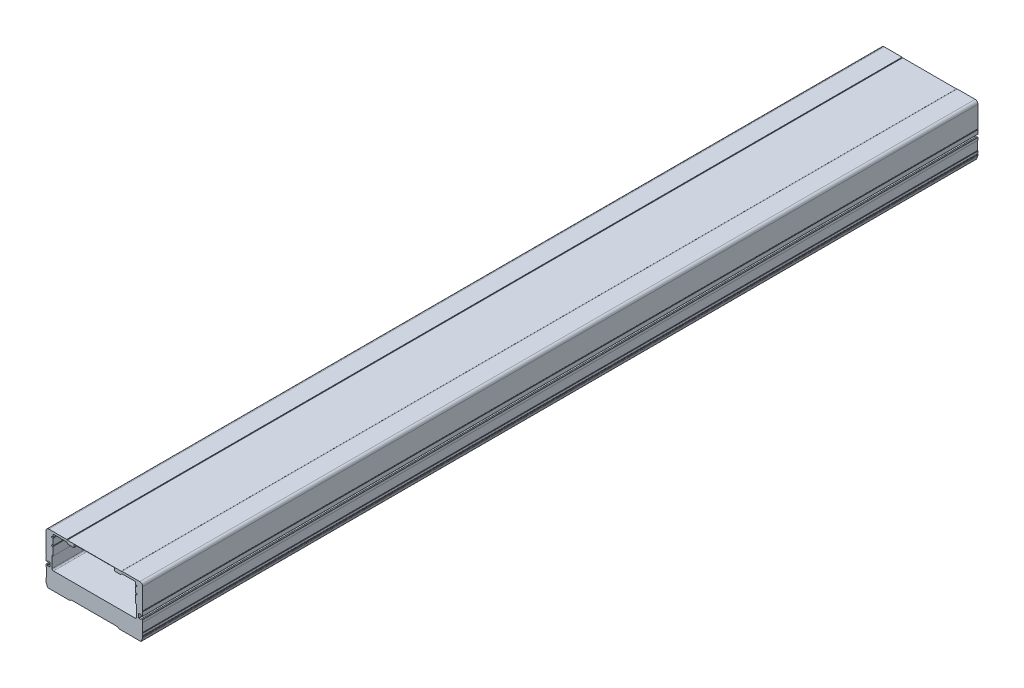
SolidWorks part; units mm, degrees
ref_plane "前视基准面" through (0, 0, 0) normal (0, 0, 1) x (1, 0, 0)
ref_plane "上视基准面" through (0, 0, 0) normal (0, 1, 0) x (1, 0, 0)
ref_plane "右视基准面" through (0, 0, 0) normal (1, 0, 0) x (0, 0, -1)
sketch "草图1" plane through (0, 0, 0) normal (0, 0, 1) x (1, 0, 0)
  line B0 (-57, 22.7) -> (57, 22.7)
  line B1 (-59, 40.3) -> (-59, 24.7)
  line B2 (-57.5, 40.6) -> (-59.3, 40.6)
  line B3 (-57.5, 52.1417) -> (-57.5, 40.6)
  line B4 (-57.5, 62.1417) -> (-57.5, 53.0583)
  line B5 (-57.5, 66.1) -> (-57.5, 63.0583)
  line B6 (-38.5, 67.1) -> (-56.5, 67.1)
  line B7 (-36.5, 65.1) -> (-38.5, 67.1)
  line B8 (-28.8, 65.1) -> (-36.5, 65.1)
  line B9 (-28.5, 69.3) -> (-28.5, 65.4)
  line B10 (28.5, 69.3) -> (-28.5, 69.3)
  line B11 (28.5, 65.4) -> (28.5, 69.3)
  line B12 (36.5, 65.1) -> (28.8, 65.1)
  line B13 (38.5, 67.1) -> (36.5, 65.1)
  line B14 (56.5, 67.1) -> (38.5, 67.1)
  line B15 (57.5, 63.0583) -> (57.5, 66.1)
  line B16 (57.5, 53.0583) -> (57.5, 62.1417)
  line B17 (57.5, 40.6) -> (57.5, 52.1417)
  line B18 (59, 40.6) -> (57.5, 40.6)
  line B19 (59, 24.7) -> (59, 40.6)
  line B20 (-67.5, 66.1) -> (-67.5, 36.6047)
  line B21 (-67.5, 35.3953) -> (-67.5, 30.1)
  line B22 (-67.2, 29.8) -> (-65.8, 29.8)
  line B23 (-65.5, 30.1) -> (-65.5, 30.7)
  line B24 (-65.2, 31) -> (-62.3, 31)
  line B25 (-62, 30.7) -> (-62, 25.3)
  line B26 (-62.3, 25) -> (-65.2, 25)
  line B27 (-65.5, 25.3) -> (-65.5, 25.9)
  line B28 (-65.8, 26.2) -> (-67.2, 26.2)
  line B29 (-67.5, 25.9) -> (-67.5, 22.5)
  line B30 (-67.5, 22.5) -> (-67, 22)
  line B31 (-67, 22) -> (-67, 10)
  line B32 (-67, 10) -> (-67.5, 9.5)
  line B33 (-67.5, 9.5) -> (-67.5, 6.6047)
  line B34 (-67.5, 5.3953) -> (-67.5, 4.382)
  line B35 (-67.3592, 3.6449) -> (-65.5064, -1.0289)
  line B36 (-65.16, -1.6) -> (-34.1, -1.6)
  line B37 (-34.1, -1.6) -> (-32.5, 0)
  line B38 (-32.5, 0) -> (32.5, 0)
  line B39 (32.5, 0) -> (34.1, -1.6)
  line B40 (34.1, -1.6) -> (65.16, -1.6)
  line B41 (65.5064, -1.0289) -> (67.3592, 3.6449)
  line B42 (67.5, 4.382) -> (67.5, 5.3953)
  line B43 (67.5, 6.6047) -> (67.5, 9.5)
  line B44 (67.5, 9.5) -> (67, 10)
  line B45 (67, 10) -> (67, 22)
  line B46 (67, 22) -> (67.5, 22.5)
  line B47 (67.5, 22.5) -> (67.5, 25.9)
  line B48 (67.2, 26.2) -> (65.8, 26.2)
  line B49 (65.5, 25.9) -> (65.5, 25.3)
  line B50 (65.2, 25) -> (62.3, 25)
  line B51 (62, 25.3) -> (62, 30.7)
  line B52 (62.3, 31) -> (65.2, 31)
  line B53 (65.5, 30.7) -> (65.5, 30.1)
  line B54 (65.8, 29.8) -> (67.2, 29.8)
  line B55 (67.5, 30.1) -> (67.5, 35.3953)
  line B56 (67.5, 36.6047) -> (67.5, 66.1)
  line B57 (63.5, 70.1) -> (38.5, 70.1)
  line B58 (38.5, 70.1) -> (38, 69.6)
  line B59 (38, 69.6) -> (37.5, 69.6)
  line B60 (37.5, 69.6) -> (37.5, 69.7)
  line B61 (37.5, 69.7) -> (-37.5, 69.7)
  line B62 (-37.5, 69.7) -> (-37.5, 69.6)
  line B63 (-37.5, 69.6) -> (-38, 69.6)
  line B64 (-38, 69.6) -> (-38.5, 70.1)
  line B65 (-38.5, 70.1) -> (-63.5, 70.1)
  arc B66 (-59, 24.7) -> (-57, 22.7) centre (-57, 24.7) ccw
  arc B67 (-59, 40.3) -> (-59.3, 40.6) centre (-59.3, 40.3) ccw
  arc B68 (-57.5, 53.0583) -> (-57.5, 52.1417) centre (-58.5, 52.6) ccw
  arc B69 (-57.5, 63.0583) -> (-57.5, 62.1417) centre (-58.5, 62.6) ccw
  arc B70 (-56.5, 67.1) -> (-57.5, 66.1) centre (-56.5, 66.1) ccw
  arc B71 (-28.8, 65.1) -> (-28.5, 65.4) centre (-28.8, 65.4) ccw
  arc B72 (28.5, 65.4) -> (28.8, 65.1) centre (28.8, 65.4) ccw
  arc B73 (57.5, 66.1) -> (56.5, 67.1) centre (56.5, 66.1) ccw
  arc B74 (57.5, 62.1417) -> (57.5, 63.0583) centre (58.5, 62.6) ccw
  arc B75 (57.5, 52.1417) -> (57.5, 53.0583) centre (58.5, 52.6) ccw
  arc B76 (57, 22.7) -> (59, 24.7) centre (57, 24.7) ccw
  arc B77 (-67.5, 36.6047) -> (-67.3333, 36.3359) centre (-67.2, 36.6047) ccw
  arc B78 (-67.3333, 35.6641) -> (-67.3333, 36.3359) centre (-67.5, 36) ccw
  arc B79 (-67.3333, 35.6641) -> (-67.5, 35.3953) centre (-67.2, 35.3953) ccw
  arc B80 (-67.5, 30.1) -> (-67.2, 29.8) centre (-67.2, 30.1) ccw
  arc B81 (-65.8, 29.8) -> (-65.5, 30.1) centre (-65.8, 30.1) ccw
  arc B82 (-65.2, 31) -> (-65.5, 30.7) centre (-65.2, 30.7) ccw
  arc B83 (-62, 30.7) -> (-62.3, 31) centre (-62.3, 30.7) ccw
  arc B84 (-62.3, 25) -> (-62, 25.3) centre (-62.3, 25.3) ccw
  arc B85 (-65.5, 25.3) -> (-65.2, 25) centre (-65.2, 25.3) ccw
  arc B86 (-65.5, 25.9) -> (-65.8, 26.2) centre (-65.8, 25.9) ccw
  arc B87 (-67.2, 26.2) -> (-67.5, 25.9) centre (-67.2, 25.9) ccw
  arc B88 (-67.5, 6.6047) -> (-67.3333, 6.3359) centre (-67.2, 6.6047) ccw
  arc B89 (-67.3333, 5.6641) -> (-67.3333, 6.3359) centre (-67.5, 6) ccw
  arc B90 (-67.3333, 5.6641) -> (-67.5, 5.3953) centre (-67.2, 5.3953) ccw
  arc B91 (-67.5, 4.382) -> (-67.3592, 3.6449) centre (-65.5, 4.382) ccw
  arc B92 (-65.5064, -1.0289) -> (-65.16, -1.6) centre (-63.6472, -0.2918) ccw
  arc B93 (65.16, -1.6) -> (65.5064, -1.0289) centre (63.6472, -0.2918) ccw
  arc B94 (67.3592, 3.6449) -> (67.5, 4.382) centre (65.5, 4.382) ccw
  arc B95 (67.5, 5.3953) -> (67.3333, 5.6641) centre (67.2, 5.3953) ccw
  arc B96 (67.3333, 6.3359) -> (67.3333, 5.6641) centre (67.5, 6) ccw
  arc B97 (67.3333, 6.3359) -> (67.5, 6.6047) centre (67.2, 6.6047) ccw
  arc B98 (67.5, 25.9) -> (67.2, 26.2) centre (67.2, 25.9) ccw
  arc B99 (65.8, 26.2) -> (65.5, 25.9) centre (65.8, 25.9) ccw
  arc B100 (65.2, 25) -> (65.5, 25.3) centre (65.2, 25.3) ccw
  arc B101 (62, 25.3) -> (62.3, 25) centre (62.3, 25.3) ccw
  arc B102 (62.3, 31) -> (62, 30.7) centre (62.3, 30.7) ccw
  arc B103 (65.5, 30.7) -> (65.2, 31) centre (65.2, 30.7) ccw
  arc B104 (65.5, 30.1) -> (65.8, 29.8) centre (65.8, 30.1) ccw
  arc B105 (67.2, 29.8) -> (67.5, 30.1) centre (67.2, 30.1) ccw
  arc B106 (67.5, 35.3953) -> (67.3333, 35.6641) centre (67.2, 35.3953) ccw
  arc B107 (67.3333, 36.3359) -> (67.3333, 35.6641) centre (67.5, 36) ccw
  arc B108 (67.3333, 36.3359) -> (67.5, 36.6047) centre (67.2, 36.6047) ccw
  arc B109 (67.5, 66.1) -> (63.5, 70.1) centre (63.5, 66.1) ccw
  arc B110 (-63.5, 70.1) -> (-67.5, 66.1) centre (-63.5, 66.1) ccw
sketch_block_instance "块1-1"
sketch_block "块1"
extrude "凸台-拉伸1" add sketch "草图1" against normal blind 1167
hole_wizard " 螺纹孔M6" positions "草图5" profile "草图6" tap size "M6" standard "GB"
sketch "草图5" plane through (0, -1.6, 0) normal (0, -1, 0) x (-1, 0, 0)
  line L5 (65.16, 1167) -> (34.1, 1167) construction
  line L6 (0, 1167) -> (0, 1237.2993) construction
  line L7 (32.5, 1167) -> (-32.5, 1167) construction
  point P0 (53, 1115.5)
  point P2 (-53, 1115.5)
  point P12 (53, 1065.5)
  point P14 (-53, 1065.5)
  point P19 (-53, 865.5)
  point P21 (53, 865.5)
  point P23 (-53, 665.5)
  point P25 (53, 665.5)
  point P27 (-53, 465.5)
  point P29 (53, 465.5)
  point P31 (-53, 265.5)
  point P33 (53, 265.5)
  point P36 (53, 65.5)
  point P38 (-53, 65.5)
  dimension "D1" = 51.5
  dimension "D2" = 50
  dimension "D3" = 200
  dimension "D4" = 200
  dimension "D5" = 200
  dimension "D6" = 200
  dimension "D7" = 200
  dimension "D8" = 106
sketch "草图6" plane through (-53, -1.6, -1115.5) normal (1, 0, 0) x (0, 0, -1)
  line L0 (0, 0) -> (0, 16.5022)
  line L1 (0, 16.5022) -> (2.5, 15)
  line L2 (2.5, 15) -> (2.5, 0)
  line L5 (2.5, 0) -> (0, 0)
  line L10 (0, 16.5022) -> (-2.5, 15) construction
  line L11 (0, -6.35) -> (0, 107.95) construction
  dimension "螺纹孔钻头直径" = 5
  dimension "螺纹孔钻头深度" = 15
  dimension "导头角度" = 118
